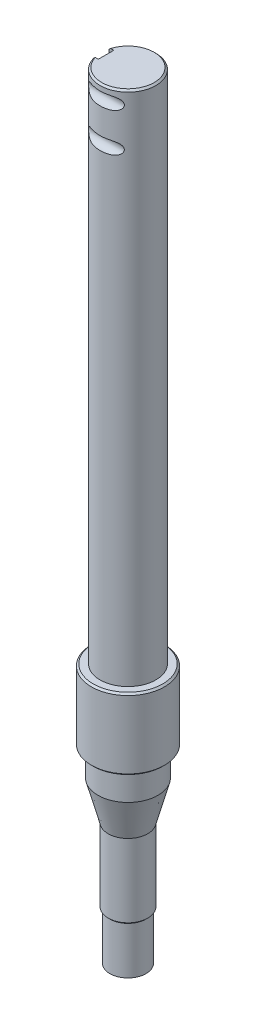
SolidWorks part; units mm, degrees
ref_plane "Plan de face" through (0, 0, 0) normal (0, 0, 1) x (1, 0, 0)
ref_plane "Plan de dessus" through (0, 0, 0) normal (0, 1, 0) x (1, 0, 0)
ref_plane "Plan de droite" through (0, 0, 0) normal (1, 0, 0) x (0, 0, -1)
sketch "Esquisse1" plane through (0, 0, 0) normal (0, 1, 0) x (1, 0, 0)
  circle A0 centre (0, 0) radius 21
  dimension "D1" = 42
extrude "Extrusion1" add sketch "Esquisse1" along normal blind 55
sketch "Esquisse2" plane through (0, 55, 0) normal (0, 1, 0) x (1, 0, 0)
  circle A0 centre (0, 0) radius 23
  dimension "D1" = 46
extrude "Extrusion2" add sketch "Esquisse2" along normal blind 87
chamfer "Chanfrein1" distance 2 angle 45 1 edges at (0, 55, 23)
sketch "Esquisse3" plane through (0, 142, 0) normal (0, 1, 0) x (1, 0, 0)
  circle A0 centre (0, 0) radius 23 construction
  circle A1 centre (0, 0) radius 23
extrude "Extrusion3" add sketch "Esquisse3" along normal blind 44.78 draft 15
sketch "Esquisse4" plane through (0, 186.78, 0) normal (0, 1, 0) x (1, 0, 0)
  circle A0 centre (0, 0) radius 34.9988 construction
  circle A1 centre (0, 0) radius 34.9988
extrude "Extrusion4" add sketch "Esquisse4" along normal blind 32
sketch "Esquisse5" plane through (0, 218.78, 0) normal (0, 1, 0) x (1, 0, 0)
  circle A0 centre (0, 0) radius 42.5
  dimension "D1" = 85
extrude "Extrusion5" add sketch "Esquisse5" along normal blind 83
chamfer "Chanfrein2" distance 2 angle 45 2 edges at (0, 301.78, 42.5) (0, 218.78, 42.5)
sketch "Esquisse6" plane through (0, 301.78, 0) normal (0, 1, 0) x (1, 0, 0)
  circle A0 centre (0, 0) radius 32.5
  dimension "D1" = 65
extrude "Extrusion6" add sketch "Esquisse6" along normal blind 601
sketch "Esquisse7" plane through (0, 0, 0) normal (1, 0, 0) x (0, 0, -1)
  line L0 (32.5, 301.78) -> (32.5, 902.78) construction
  line L1 (32.5, 902.78) -> (-32.5, 902.78) construction
  circle A0 centre (32.5, 887.78) radius 7.5
  circle A1 centre (32.5, 842.78) radius 7.5
  dimension "D1" = 15
  dimension "D2" = 15
  dimension "D3" = 15
  dimension "D4" = 60
extrude "Enlèv. mat.-Extru.1" cut sketch "Esquisse7" against normal mid plane 300
chamfer "Chanfrein3" distance 2 angle 45 1 edges at (0, 902.78, 32.5)
pattern_circular "Répétition circulaire1" count 2 every 180 about axis through (0, 902.78, 0) along (0, -1, 0) of "Enlèv. mat.-Extru.1"
sketch "Esquisse8" plane through (0, 902.78, 0) normal (0, 1, 0) x (1, 0, 0)
  line L0 (0, 0) -> (-46.5805, 0) construction
  line L1 (-32.5, 9) -> (-25.5, 9)
  line L3 (-32.5, 9) -> (-32.5, -9)
  line L4 (-32.5, -9) -> (-25.5, -9)
  line L5 (-25.5, 9) -> (-25.5, -9)
  circle A0 centre (0, 0) radius 32.5 construction
  circle A1 centre (0, 0) radius 32.5 construction
  point P12 (-25.5, 0)
  point P13 (-32.5, 0)
  dimension "D1" = 18
  dimension "D2" = 7
extrude "Enlèv. mat.-Extru.2" cut sketch "Esquisse8" against normal blind 65
fillet "Congé1" radius 9 2 edges at (-28.3645, 837.78, 9) (-28.3645, 837.78, -9)
